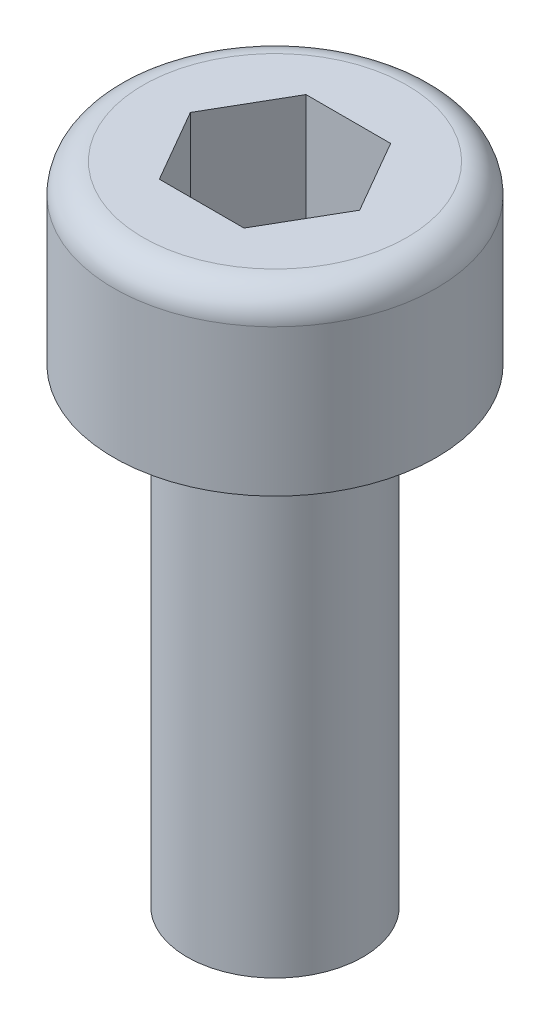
SolidWorks part; units mm, degrees
ref_plane "Plane1" through (0, 0, 0) normal (0, 0, 1) x (1, 0, 0)
ref_plane "Plane2" through (0, 0, 0) normal (0, 1, 0) x (1, 0, 0)
ref_plane "Plane3" through (0, 0, 0) normal (1, 0, 0) x (0, 0, -1)
sketch "Sketch1" plane through (0, 0, 0) normal (0, 0, 1) x (1, 0, 0)
  line L0 (0, -8.4019) -> (0, 3)
  line L1 (0, 3) -> (2.25, 3)
  line L2 (2.75, 2.5) -> (2.75, 0)
  line L3 (2.75, 0) -> (1.5, 0)
  line L4 (1.5, 0) -> (1.5, -8)
  line L5 (1.5, -8) -> (0, -8.4019)
  line L6 (0, 3) -> (0, 17) construction
  arc A0 (2.25, 3) -> (2.75, 2.5) centre (2.25, 2.5) cw
  point P10 (2.75, 3)
  dimension "D6" = 0.5
  dimension "D1" = 2.75
  dimension "D2" = 3
  dimension "D3" = 1.5
  dimension "D4" = 8
  dimension "D5" = 75
revolve "Base-Revolve" add sketch "Sketch1" angle 360 about L6
sketch "Sketch2" plane through (0, 3, 0) normal (0, 1, 0) x (-1, 0, 0)
  line L1 (-1.4434, 0) -> (-0.7217, -1.25)
  line L2 (-0.7217, -1.25) -> (0.7217, -1.25)
  line L3 (0.7217, -1.25) -> (1.4434, 0)
  line L4 (1.4434, 0) -> (0.7217, 1.25)
  line L5 (0.7217, 1.25) -> (-0.7217, 1.25)
  line L6 (-0.7217, 1.25) -> (-1.4434, 0)
  circle A0 centre (0, 0) radius 1.25 construction
  dimension "D1" = 2.5
extrude "Cut-Extrude1" cut sketch "Sketch2" against normal blind 2
